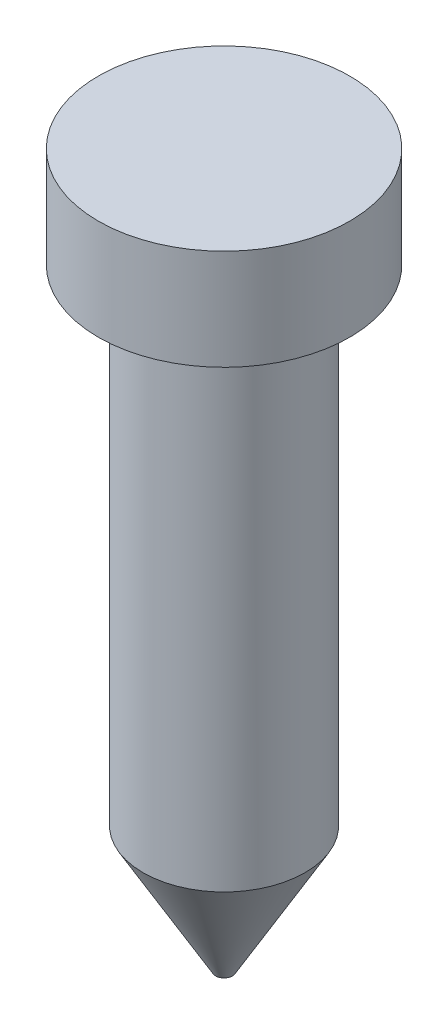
SolidWorks part; units mm, degrees
ref_plane "Front Plane" through (0, 0, 0) normal (0, 0, 1) x (1, 0, 0)
ref_plane "Top Plane" through (0, 0, 0) normal (0, 1, 0) x (1, 0, 0)
ref_plane "Right Plane" through (0, 0, 0) normal (1, 0, 0) x (0, 0, -1)
sketch "Sketch1" plane through (0, 0, 0) normal (0, 1, 0) x (1, 0, 0)
  circle A0 centre (0, 0) radius 1.4732
  dimension "D1" = 2.9464
extrude "Extrude1" add sketch "Sketch1" along normal blind 11.1252
sketch "Sketch2" plane through (0, 11.1252, 0) normal (0, 1, 0) x (-1, 0, 0)
  circle A0 centre (0, 0) radius 2.286
  dimension "D1" = 4.572
extrude "Extrude2" add sketch "Sketch2" along normal blind 1.8288
chamfer "Chamfer1" distance 1.3208 angle 60 1 edges at (0, 0, 1.4732)
